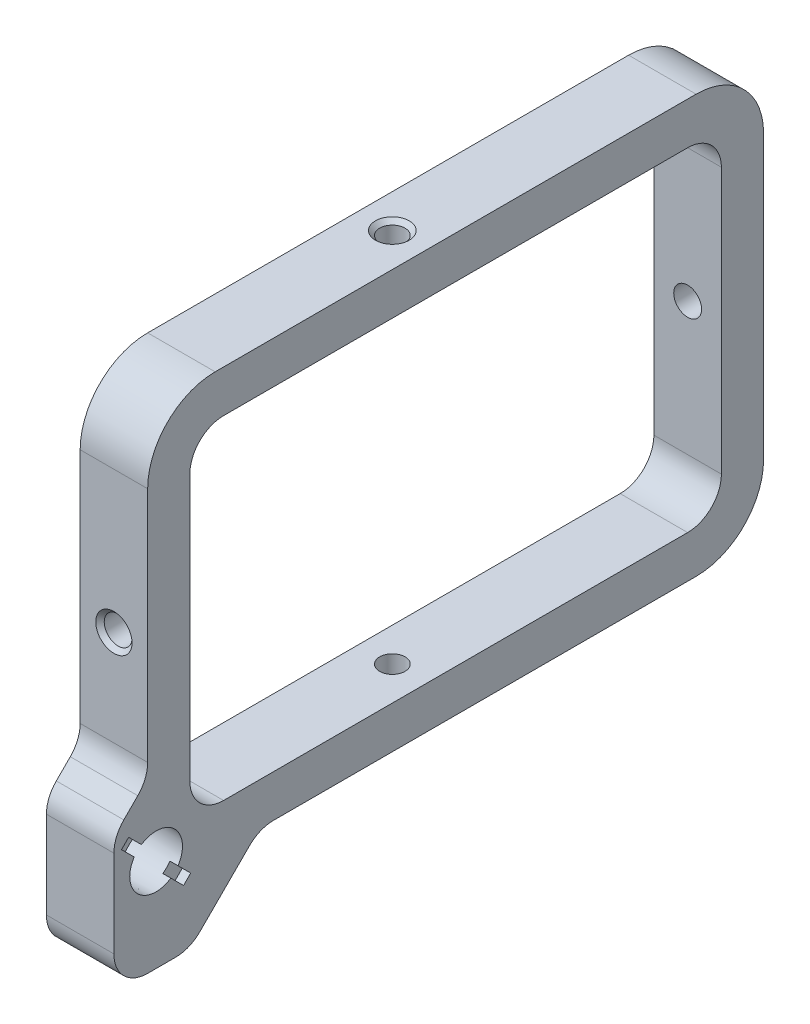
SolidWorks part; units mm, degrees
ref_plane "Front Plane" through (0, 0, 0) normal (1, 0, 0) x (0, 1, 0)
ref_plane "Top Plane" through (0, 0, 0) normal (0, 0, 1) x (0, 1, 0)
ref_plane "Right Plane" through (0, 0, 0) normal (0, 1, 0) x (-1, 0, 0)
sketch "Sketch1" plane through (0, 0, 0) normal (1, 0, 0) x (0, 1, 0)
  line L0 (-24.75, 0) -> (24.75, 0)
  line L1 (24.75, 0) -> (24.75, 73)
  line L2 (24.75, 73) -> (-13, 73)
  line L4 (-19.75, 5) -> (19.75, 5)
  line L5 (19.75, 5) -> (19.75, 68)
  line L6 (19.75, 68) -> (-19.75, 68)
  line L7 (-19.75, 68) -> (-19.75, 5)
  line L8 (0, 68) -> (0, 56) construction
  line L9 (-13, 73) -> (-17, 77)
  line L10 (-17, 77) -> (-33, 77)
  line L12 (-33, 68) -> (-24.75, 59.75)
  line L15 (-33, 77) -> (-33, 68)
  line L16 (-24.75, 59.75) -> (-24.75, 0)
  line L18 (-19.75, 5) -> (-24.75, 5) construction
  line L19 (-19.75, 5) -> (-19.75, 0) construction
  line L20 (19.75, 68) -> (19.75, 73) construction
  circle A2 centre (-22, 72) radius 3.125
  point P4 (0, 0)
  point P10 (0, 5)
  dimension "D6" = 4
  dimension "D7" = 6.25
  dimension "D1" = 39.5
  dimension "D2" = 135
  dimension "D3" = 33
  dimension "D4" = 63
  dimension "D5" = 17
  dimension "D8" = 22
  dimension "D9" = 4
  dimension "D12" = 5
extrude "Boss-Extrude1" add sketch "Sketch1" along normal blind 8
sketch "Sketch6" plane through (0, -24.75, 0) normal (0, -1, 0) x (1, 0, 0)
  line L0 (8, 59.75) -> (0, 59.75) construction
  circle A0 centre (4, 40) radius 1.5
  point P4 (4, 59.75)
  dimension "D2" = 3
  dimension "D1" = 28
extrude "Cut-Extrude2" cut sketch "Sketch6" against normal through all
sketch "Sketch5" plane through (0, 0, 0) normal (0, 0, -1) x (1, 0, 0)
  line L1 (8, 24.75) -> (0, 24.75) construction
  circle A0 centre (4, 0) radius 1.65
  point P5 (4, 24.75)
  dimension "D1" = 3.3
extrude "Cut-Extrude4" cut sketch "Sketch5" against normal through all
chamfer "Chamfer1" distance 0.5 angle 45 4 edges at (4, 24.75, 38.5) (4, -24.75, 38.5) (2.35, 0, 0) (2.35, 0, 73)
sketch "Sketch8" plane through (8, 0, 0) normal (1, 0, 0) x (0, 1, 0)
  line L0 (-25.677, 68.323) -> (-18.323, 75.677) construction
  line L1 (19.75, 68) -> (-19.75, 68) construction
  line L2 (-18.7473, 76.1012) -> (-17.8988, 75.2527)
  line L3 (-17.8988, 75.2527) -> (-25.2527, 67.8988)
  line L4 (-25.2527, 67.8988) -> (-26.1012, 68.7473)
  line L5 (-26.1012, 68.7473) -> (-18.7473, 76.1012)
  point P4 (-22, 72)
  point P5 (-22, 72)
  point P10 (-18.323, 75.677)
  dimension "D1" = 10.4
  dimension "D2" = 45
  dimension "D3" = 1.2
extrude "Cut-Extrude3" cut sketch "Sketch8" against normal blind 1
fillet "Fillet1" radius 4 5 edges at (4, -33, 68) (4, -24.75, 59.75) (4, -33, 77) (4, -17, 77) (4, -13, 73)
fillet "Fillet2" radius 8 3 edges at (4, -24.75, 0) (4, 24.75, 0) (4, 24.75, 73)
fillet "Fillet3" radius 4 4 edges at (4, -19.75, 68) (4, -19.75, 5) (4, 19.75, 5) (4, 19.75, 68)
chamfer "Chamfer2" distance 8 distance2 0.5 1 edges at (0, -22, 68.875)
